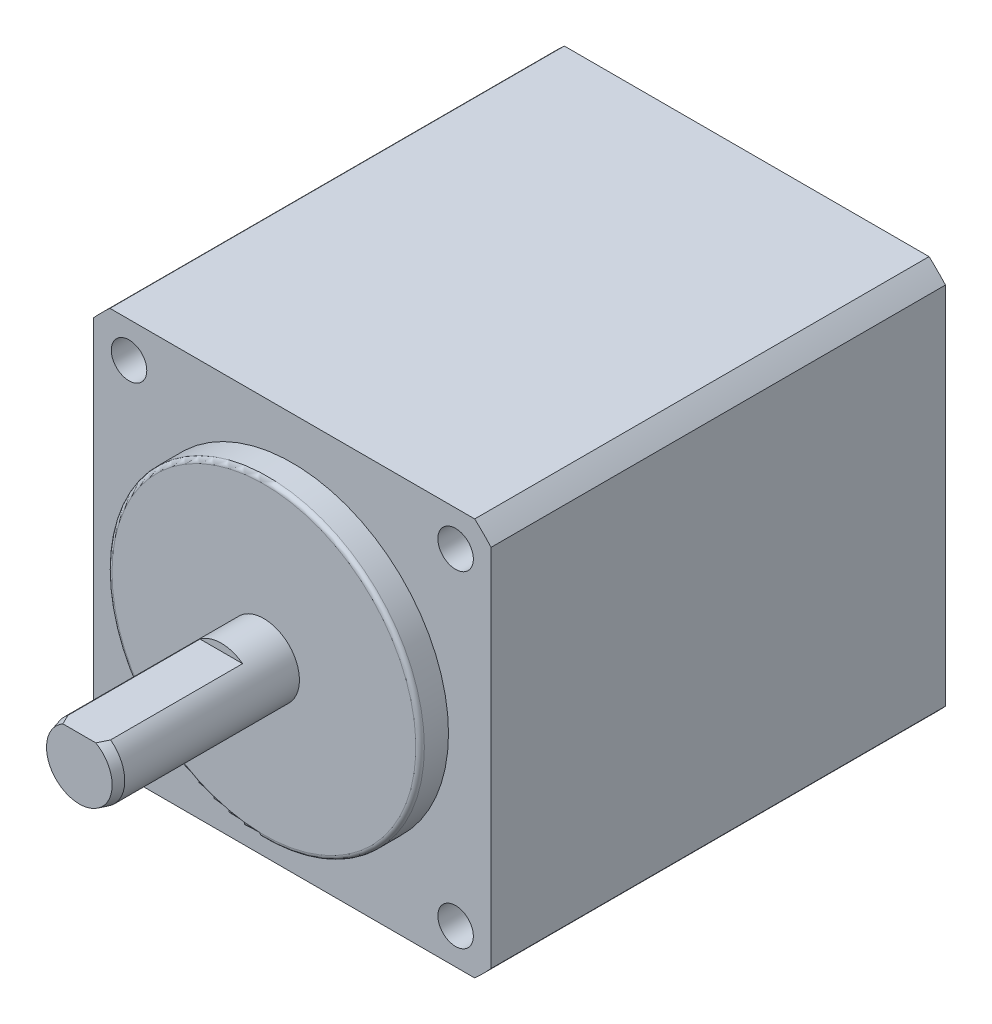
SolidWorks part; units mm, degrees
ref_plane "正面" through (0, 0, 0) normal (0, 0, 1) x (1, 0, 0)
ref_plane "平面" through (0, 0, 0) normal (0, 1, 0) x (1, 0, 0)
ref_plane "右側面" through (0, 0, 0) normal (1, 0, 0) x (0, 0, -1)
sketch "Sketch1" plane through (0, 0, 0) normal (0, 0, 1) x (1, 0, 0)
  circle A0 centre (0, 0) radius 2.5
  dimension "D1" = 5
extrude "Extrude1" add sketch "Sketch1" along normal blind 15
sketch "Sketch2" plane through (0, 0, 0) normal (0, 0, -1) x (-1, 0, 0)
  circle A0 centre (0, 0) radius 11
  dimension "D1" = 22
extrude "Extrude2" add sketch "Sketch2" against normal blind 2
sketch "Sketch3" plane through (0, 0, 0) normal (0, 0, -1) x (-1, 0, 0)
  line L1 (14, -14) -> (-14, -14)
  line L2 (14, -14) -> (14, 14)
  line L3 (14, 14) -> (-14, 14)
  line L4 (-14, -14) -> (-14, 14)
  line L5 (14, -14) -> (-14, 14) construction
  line L6 (14, 14) -> (-14, -14) construction
  circle A0 centre (0, 0) radius 19
  point P0 (0, 0)
  dimension "D3" = 38
  dimension "D1" = 28
  dimension "D2" = 28
extrude "Extrude3" add sketch "Sketch3" along normal blind 32 separate body contours L2 A0 L3 L4 L1 M1 | M1
sketch "Sketch4" plane through (0, -14, 0) normal (0, -1, 0) x (1, 0, 0)
  line L0 (-12.8452, -32) -> (12.8452, -32) construction
  line L1 (-7.6, -32) -> (7.6, -32)
  line L2 (-7.6, -32) -> (-7.6, -22.5)
  line L3 (-7.6, -22.5) -> (7.6, -22.5)
  line L4 (7.6, -32) -> (7.6, -22.5)
  dimension "D1" = 9.5
  dimension "D2" = 15.2
  dimension "D3" = 7.6
extrude "Extrude4" add sketch "Sketch4" along normal blind 5
sketch "Sketch5" plane through (0, 0, 15) normal (0, 0, 1) x (1, 0, 0)
  line L1 (-2.5379, 4.1995) -> (2.6225, 4.1995)
  line L2 (-2.5379, 4.1995) -> (-2.5379, 2)
  line L3 (-2.5379, 2) -> (2.6225, 2)
  line L4 (2.6225, 4.1995) -> (2.6225, 2)
  dimension "D1" = 2
extrude "Extrude5" cut sketch "Sketch5" against normal blind 10
chamfer "Chamfer1" distance 0.7 angle 15 1 edges at (0, -2.5, 15)
sketch "Sketch6" plane through (0, 0, 0) normal (0, 0, 1) x (1, 0, 0)
  line L1 (11.5, -11.5) -> (-11.5, -11.5) construction
  line L2 (11.5, -11.5) -> (11.5, 11.5) construction
  line L3 (11.5, 11.5) -> (-11.5, 11.5) construction
  line L4 (-11.5, -11.5) -> (-11.5, 11.5) construction
  line L5 (11.5, -11.5) -> (-11.5, 11.5) construction
  line L6 (11.5, 11.5) -> (-11.5, -11.5) construction
  circle A0 centre (-11.5, 11.5) radius 1.25
  circle A1 centre (11.5, 11.5) radius 1.25
  circle A2 centre (-11.5, -11.5) radius 1.25
  circle A3 centre (11.5, -11.5) radius 1.25
  point P0 (0, 0)
  dimension "D3" = 2.5
  dimension "D1" = 23
  dimension "D2" = 23
extrude "Extrude6" cut sketch "Sketch6" against normal blind 4.5
fillet "Fillet2" radius 0.3 1 edges at (-11, 0, 2)
sketch "Sketch7" plane through (0, 0, -32) normal (0, 0, -1) x (-1, 0, 0)
  line L0 (-1.5, 2) -> (1.5, 2)
  circle A0 centre (0, 0) radius 2.5
  dimension "D1" = 5
  dimension "D2" = 2
extrude "Extrude7" add sketch "Sketch7" along normal blind 10 contours L0 A0
chamfer "Chamfer2" distance 0.7 angle 15 1 edges at (0, -2.5, -42)
